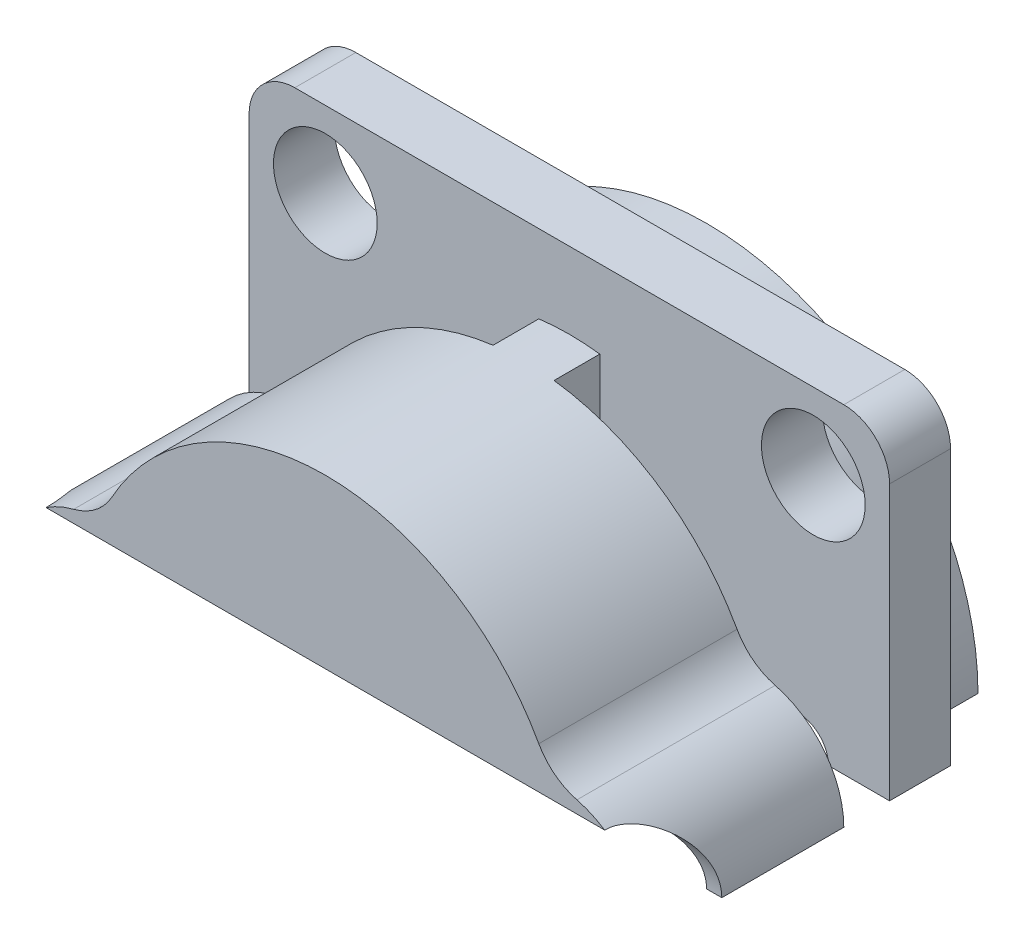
SolidWorks part; units mm, degrees
ref_plane "Plan de face" through (0, 0, 0) normal (0, 0, 1) x (1, 0, 0)
ref_plane "Plan de dessus" through (0, 0, 0) normal (0, 1, 0) x (1, 0, 0)
ref_plane "Plan de droite" through (0, 0, 0) normal (1, 0, 0) x (0, 0, -1)
sketch "Esquisse1" plane through (0, 0, 0) normal (0, 0, 1) x (1, 0, 0)
  line L1 (-21, 21) -> (0, 21)
  line L2 (-21, 21) -> (-21, 0)
  line L3 (-21, 0) -> (0, 0)
  line L4 (0, 21) -> (0, 0)
  dimension "D1" = 21
  dimension "D2" = 21
extrude "Extrusion1" add sketch "Esquisse1" along normal blind 2
sketch "Esquisse2" plane through (0, 0, 2) normal (0, 0, 1) x (1, 0, 0)
  line L0 (-21, 21) -> (-21, 0) construction
  line L1 (0, 21) -> (-21, 21) construction
  circle A0 centre (-10.5, 10.5) radius 8
  point P4 (-10.5, 21)
  dimension "D3" = 16
  dimension "D1" = 10.5
  dimension "D2" = 10.5
extrude "Extrusion2" add sketch "Esquisse2" along normal blind 8
ref_plane "Plan1" through (0, 10.5, 0) normal (0, 1, 0) x (-1, 0, 0)
hole_wizard "Dégagement M31" positions "Esquisse6" profile "Esquisse5" hole size "M3" standard "ISO"
sketch "Esquisse6" plane through (0, 0, 2) normal (0, 0, 1) x (1, 0, 0)
  line L0 (0, 0) -> (0, 21) construction
  line L1 (0, 21) -> (-21, 21) construction
  point P0 (-2.5, 18.5)
  dimension "D1" = 2.5
  dimension "D2" = 2.5
sketch "Esquisse5" plane through (-2.5, 18.5, 2) normal (1, 0, 0) x (0, -1, 0)
  line L0 (0, 0) -> (0, 2)
  line L1 (0, 2) -> (1.7, 2)
  line L2 (1.7, 2) -> (1.7, 0)
  line L5 (1.7, 0) -> (0, 0)
  line L11 (0, -6.35) -> (0, 107.95) construction
  dimension "Diamètre du perçage jusqu'au prochain" = 3.4
  dimension "Profondeur du perçage jusqu'au prochain" = 2
pattern_linear "Répétition linéaire1" count 2 spacing 16 along (0, -1, 0) count 2 spacing 16 along (-1, 0, 0) of "Dégagement M31"
fillet "Congé1" radius 1.5 4 edges at (-21, 21, 1) (0, 21, 1) (0, 0, 1) (-21, 0, 1)
sketch "Esquisse7" plane through (0, 0, 0) normal (0, 0, -1) x (-1, 0, 0)
  line L0 (0, 1.5) -> (0, 19.5) construction
  line L1 (1.5, 21) -> (19.5, 21) construction
  circle A0 centre (10.5, 10.5) radius 8.9
  dimension "D3" = 17.8
  dimension "D1" = 10.5
  dimension "D2" = 10.5
extrude "Extrusion4" add sketch "Esquisse7" along normal blind 2.5
sketch "Esquisse8" plane through (0, 0, -2.5) normal (0, 0, -1) x (-1, 0, 0)
  circle A0 centre (10.5, 10.5) radius 4.5308
  circle A1 centre (10.5, 10.5) radius 8.9 construction
extrude "Enlèv. mat.-Extru.2" cut sketch "Esquisse8" against normal blind 2.5
sketch "Esquisse9" plane through (0, 0, 0) normal (0, 0, -1) x (-1, 0, 0)
  circle A0 centre (10.5, 10.5) radius 2.5
  circle A1 centre (10.5, 10.5) radius 4.5308 construction
  dimension "D1" = 5
extrude "Enlèv. mat.-Extru.6" cut sketch "Esquisse9" against normal up to next
sketch "Esquisse10" plane through (0, 0, 2) normal (0, 0, 1) x (1, 0, 0)
  line L0 (-1.5, 21) -> (-19.5, 21) construction
  line L2 (-21, 19.5) -> (-21, 1.5) construction
  circle A0 centre (-18, 10.5) radius 3
  circle A1 centre (-3, 10.5) radius 3
  dimension "D1" = 6
  dimension "D2" = 6
  dimension "D4" = 3
  dimension "D5" = 10.5
  dimension "D3" = 10.5
  dimension "D6" = 15
extrude "Extrusion5" add sketch "Esquisse10" along normal blind 8
fillet "Congé2" radius 2 4 edges at (-17.9167, 13.4988, 6) (-17.9167, 7.5012, 6) (-3.0833, 7.5012, 6) (-3.0833, 13.4988, 6)
sketch "Esquisse11" plane through (0, 21, 0) normal (0, 1, 0) x (-1, 0, 0)
  line L0 (21, 2) -> (21, 10) construction
  line L1 (0, 2) -> (9.5, 2)
  line L2 (0, 2) -> (0, 3.5)
  line L3 (0, 3.5) -> (9.5, 3.5)
  line L4 (9.5, 2) -> (9.5, 3.5)
  line L5 (11.5, 2) -> (21, 2)
  line L6 (11.5, 2) -> (11.5, 3.5)
  line L7 (11.5, 3.5) -> (21, 3.5)
  line L8 (21, 2) -> (21, 3.5)
  dimension "D1" = 9.5
  dimension "D2" = 1.5
  dimension "D3" = 1.5
  dimension "D4" = 2
extrude "Enlèv. mat.-Extru.7" cut sketch "Esquisse11" against normal through all
hole_wizard "Chambrage pour vis à tête ronde bombée M22" positions "Esquisse18" profile "Esquisse17" counterbore size "M2" standard "Ansi Métrique"
sketch "Esquisse18" plane through (0, 0, 10) normal (0, 0, 1) x (1, 0, 0)
  arc A0 (-18.75, 13.4047) -> (-18.75, 7.5953) centre (-18, 10.5) ccw construction
  point P0 (-18, 10.5)
sketch "Esquisse17" plane through (-18, 10.5, 10) normal (1, 0, 0) x (0, -1, 0)
  line L0 (0, 0) -> (0, 6.5)
  line L1 (0, 6.5) -> (1.1, 6.5)
  line L3 (1.1, 6.5) -> (1.1, 5)
  line L4 (1.1, 5) -> (2.5, 5)
  line L5 (2.5, 5) -> (2.5, 0)
  line L7 (2.5, 0) -> (0, 0)
  line L11 (0, -6.35) -> (0, 107.95) construction
  dimension "Diamètre du perçage jusqu'au prochain" = 2.2
  dimension "Profondeur du perçage jusqu'au prochain" = 6.5
  dimension "Diamètre du chambrage" = 5
  dimension "Profondeur du chambrage" = 5
sketch "Esquisse20" plane through (-21, 0, 0) normal (-1, 0, 0) x (0, 0, 1)
  line L0 (10, 7.5953) -> (10, 13.4047) construction
  line L1 (0, 0) -> (2, 0) construction
  circle A0 centre (10, 10.5) radius 2.5
  dimension "D1" = 10.5
extrude "Enlèv. mat.-Extru.9" cut sketch "Esquisse20" against normal through all
hole_wizard "Chambrage pour vis à tête ronde bombée M23" positions "Esquisse23" profile "Esquisse22" counterbore size "M2" standard "Ansi Métrique"
sketch "Esquisse23" plane through (0, 0, 10) normal (0, 0, 1) x (1, 0, 0)
  arc A0 (-1.3417, 8) -> (-1.3417, 13) centre (-3, 10.5) ccw construction
  point P0 (-3, 10.5)
sketch "Esquisse22" plane through (-3, 10.5, 10) normal (1, 0, 0) x (0, -1, 0)
  line L0 (0, 0) -> (0, 6.5)
  line L1 (0, 6.5) -> (1.1, 6.5)
  line L3 (1.1, 6.5) -> (1.1, 5)
  line L4 (1.1, 5) -> (2.5, 5)
  line L5 (2.5, 5) -> (2.5, 0)
  line L7 (2.5, 0) -> (0, 0)
  line L11 (0, -6.35) -> (0, 107.95) construction
  dimension "Diamètre du perçage jusqu'au prochain" = 2.2
  dimension "Profondeur du perçage jusqu'au prochain" = 6.5
  dimension "Diamètre du chambrage" = 5
  dimension "Profondeur du chambrage" = 5
hole_wizard "Trou taraudé M2x0.42" positions "Esquisse29" profile "Esquisse28" tap size "M2x0.4" standard "Ansi Métrique"
sketch "Esquisse29" plane through (0, 0, 2) normal (0, 0, 1) x (1, 0, 0)
  circle A0 centre (-18, 10.5) radius 1.1 construction
  point P0 (-18, 10.5)
sketch "Esquisse28" plane through (-18, 10.5, 2) normal (1, 0, 0) x (0, -1, 0)
  line L0 (0, 0) -> (0, 4.5)
  line L1 (0, 4.5) -> (1, 4.5)
  line L2 (1, 4.5) -> (1, 0)
  line L5 (1, 0) -> (0, 0)
  line L11 (0, -6.35) -> (0, 107.95) construction
  dimension "Diamètre principal du filetage" = 2
  dimension "Profondeur du trou pour taraudage jusqu'au prochain" = 4.5
hole_wizard "Trou taraudé M2x0.43" positions "Esquisse31" profile "Esquisse30" tap size "M2x0.4" standard "Ansi Métrique"
sketch "Esquisse31" plane through (0, 0, 2) normal (0, 0, 1) x (1, 0, 0)
  circle A0 centre (-3, 10.5) radius 1.1 construction
  point P0 (-3, 10.5)
sketch "Esquisse30" plane through (-3, 10.5, 2) normal (1, 0, 0) x (0, -1, 0)
  line L0 (0, 0) -> (0, 4.5)
  line L1 (0, 4.5) -> (1, 4.5)
  line L2 (1, 4.5) -> (1, 0)
  line L5 (1, 0) -> (0, 0)
  line L11 (0, -6.35) -> (0, 107.95) construction
  dimension "Diamètre principal du filetage" = 2
  dimension "Profondeur du trou pour taraudage jusqu'au prochain" = 4.5
sketch "Esquisse34" plane through (0, 0, 0) normal (0, 0, -1) x (-1, 0, 0)
  line L1 (0, 10.5) -> (21.0113, 10.5)
  line L2 (0, 10.5) -> (0, 0)
  line L3 (0, 0) -> (21.0113, 0)
  line L4 (21.0113, 10.5) -> (21.0113, 0)
  dimension "D1" = 10.5
extrude "Enlèv. mat.-Extru.11" cut sketch "Esquisse34" against normal mid plane 20
